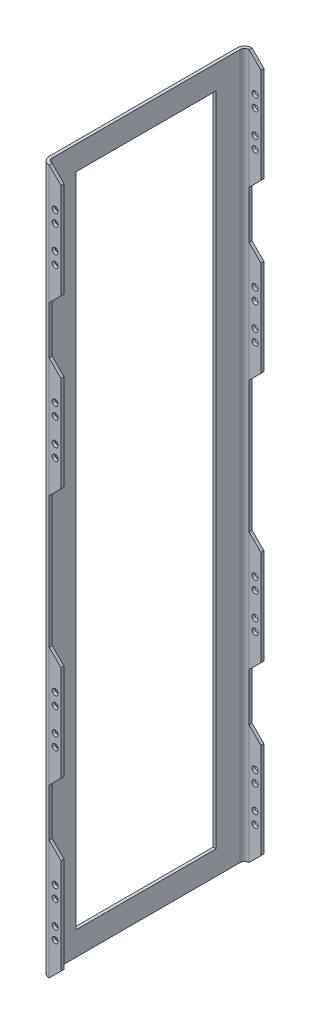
SolidWorks part; units mm, degrees
ref_plane "Front Plane" through (0, 0, 0) normal (0, 0, 1) x (1, 0, 0)
ref_plane "Top Plane" through (0, 0, 0) normal (0, 1, 0) x (1, 0, 0)
ref_plane "Right Plane" through (0, 0, 0) normal (1, 0, 0) x (0, 0, -1)
sketch "Sketch1" plane through (0, 0, 0) normal (0, 1, 0) x (1, 0, 0)
  line L0 (-51.5874, 0) -> (49.9999, 0) construction
  line L1 (-49.9999, -49.9999) -> (49.9999, -49.9999) construction
  line L2 (-49.9999, -49.9999) -> (-49.9999, 49.9999) construction
  line L3 (-49.9999, 49.9999) -> (49.9999, 49.9999) construction
  line L4 (49.9999, -49.9999) -> (49.9999, 49.9999) construction
  line L5 (-49.9999, -49.9999) -> (-51.5874, -49.9999) construction
  line L6 (-49.9999, 49.9999) -> (-49.9999, -49.9999)
  line L7 (-41.2686, -53.9686) -> (-41.2686, -52.3812)
  line L8 (-51.5874, 49.9999) -> (-51.5874, -49.9999)
  line L9 (-47.6186, -52.3811) -> (-41.2686, -52.3812)
  line L10 (-47.6186, -53.9686) -> (-41.2686, -53.9686)
  line L11 (-47.6186, 53.9686) -> (-41.2686, 53.9686)
  line L13 (-47.6186, 52.3811) -> (-41.2686, 52.3812)
  line L14 (-41.2686, 53.9686) -> (-41.2686, 52.3812)
  arc A0 (-47.6186, 52.3811) -> (-49.9999, 49.9999) centre (-47.6186, 49.9999) ccw
  arc A1 (-47.6186, 52.3811) -> (-49.9999, 49.9999) centre (-47.6186, 49.9999) ccw
  arc A2 (-47.6186, 53.9686) -> (-51.5874, 49.9999) centre (-47.6186, 49.9999) ccw
  arc A3 (-47.6186, -53.9686) -> (-51.5874, -49.9999) centre (-47.6186, -49.9999) cw
  arc A4 (-47.6186, -52.3811) -> (-49.9999, -49.9999) centre (-47.6186, -49.9999) cw
  arc A5 (-47.6186, -52.3811) -> (-49.9999, -49.9999) centre (-47.6186, -49.9999) cw
  circle A6 centre (0, 0) radius 76.2 construction
  dimension "D9" = 3.9688
  dimension "D7" = 152.4
  dimension "D1" = 49.9999
  dimension "D2" = 49.9999
  dimension "D3" = 6.35
  dimension "D4" = 49.9999
  dimension "D5" = 49.9999
  dimension "D6" = 1.5875
extrude "MainPlateExtrude" add sketch "Sketch1" along normal blind 374.65 contours L9 A4 L6 A0 L13 L14 L11 A2 L8 A3 L10 L7
sketch "Sketch2" plane through (0, 0, 53.9686) normal (0, 0, 1) x (1, 0, 0)
  line L0 (-47.6186, 374.65) -> (-41.2686, 368.3)
  line L1 (-41.2686, 374.65) -> (-41.2686, 0) construction
  line L2 (-47.6186, 285.75) -> (-41.2686, 279.4)
  line L3 (-47.6186, 374.65) -> (-47.6186, 0) construction
  line L4 (-41.2686, 317.5) -> (-47.6186, 311.15)
  line L5 (-47.6186, 374.65) -> (-41.2686, 374.65)
  line L6 (-41.2686, 374.65) -> (-41.2686, 368.3)
  line L7 (-41.2686, 317.5) -> (-41.2686, 0)
  line L8 (-41.2686, 0) -> (-47.6186, 0)
  line L9 (-47.6186, 0) -> (-41.2686, 6.35)
  line L10 (-47.6186, 63.5) -> (-41.2686, 57.15)
  line L11 (-47.6186, 88.9) -> (-41.2686, 95.25)
  line L12 (-47.6186, 152.4) -> (-41.2686, 146.05)
  line L13 (-47.6186, 222.25) -> (-41.2686, 228.6)
  line L14 (-47.6186, 311.15) -> (-47.6186, 285.75)
  line L15 (-47.6186, 222.25) -> (-47.6186, 152.4)
  line L16 (-47.6186, 88.9) -> (-47.6186, 63.5)
  dimension "D1" = 45
  dimension "D2" = 50.8
  dimension "D3" = 45
  dimension "D4" = 45
  dimension "D5" = 50.8
  dimension "D6" = 45
  dimension "D7" = 25.4
  dimension "D8" = 45
  dimension "D9" = 25.4
  dimension "D10" = 45
  dimension "D11" = 50.8
  dimension "D12" = 45
  dimension "D13" = 50.8
extrude "FlangeCut" cut sketch "Sketch2" against normal blind 107.95 contours L11 L10 M12 M10 | L9 M9 M10 | L13 L12 M12 M10 | L4 L2 M10 M12 | L0 M11 M10
sketch "Sketch3" plane through (-51.5874, 0, 0) normal (-1, 0, 0) x (0, 0, 1)
  line L0 (-37.2999, 361.95) -> (-37.2999, 12.7)
  line L1 (-49.9999, 374.65) -> (49.9999, 374.65) construction
  line L2 (-49.9999, 374.65) -> (-49.9999, 0) construction
  line L3 (-49.9999, 0) -> (49.9999, 0) construction
  line L4 (49.9999, 374.65) -> (49.9999, 0) construction
  line L5 (-37.2999, 12.7) -> (37.2999, 12.7)
  line L6 (37.2999, 361.95) -> (37.2999, 12.7)
  line L7 (-37.2999, 361.95) -> (37.2999, 361.95)
  dimension "D1" = 12.7
extrude "Cut-Extrude2" cut sketch "Sketch3" against normal blind 1.5875
sketch "Sketch4" plane through (0, 0, -53.9686) normal (0, 0, -1) x (-1, 0, 0)
  line L0 (41.2686, 342.9) -> (47.6186, 342.9) construction
  line L1 (41.2686, 368.3) -> (41.2686, 317.5) construction
  line L2 (47.6186, 374.65) -> (47.6187, 311.15) construction
  line L3 (41.2686, 254) -> (47.6186, 254) construction
  line L4 (41.2686, 279.4) -> (41.2686, 228.6) construction
  line L5 (47.6186, 285.75) -> (47.6186, 222.25) construction
  line L6 (41.2686, 120.65) -> (47.6186, 120.65) construction
  line L7 (41.2686, 146.05) -> (41.2686, 95.25) construction
  line L8 (47.6186, 152.4) -> (47.6187, 88.9) construction
  line L9 (41.2686, 31.75) -> (47.6186, 31.75) construction
  line L10 (41.2686, 57.15) -> (41.2686, 6.35) construction
  line L11 (47.6186, 63.5) -> (47.6186, 0) construction
  line L12 (44.4436, 31.75) -> (44.4436, 60.325) construction
  line L13 (41.2686, 57.15) -> (47.6186, 63.5) construction
  line L14 (44.4436, 31.75) -> (44.4436, 3.175) construction
  line L15 (41.2686, 6.35) -> (47.6186, 0) construction
  line L16 (44.4436, 120.65) -> (44.4436, 92.075) construction
  line L17 (44.4436, 120.65) -> (44.4436, 149.225) construction
  circle A0 centre (44.4436, 38.1) radius 1.5875
  circle A1 centre (44.4436, 25.4) radius 1.5875
  circle A2 centre (44.4436, 44.45) radius 1.5875
  circle A3 centre (44.4436, 19.05) radius 1.5875
  circle A4 centre (44.4436, 114.3) radius 1.5875
  circle A5 centre (44.4436, 127) radius 1.5875
  circle A6 centre (44.4436, 133.35) radius 1.5875
  circle A7 centre (44.4436, 107.95) radius 1.5875
  circle A8 centre (44.4436, 336.55) radius 1.5875
  circle A9 centre (44.4436, 260.35) radius 1.5875
  circle A10 centre (44.4436, 349.25) radius 1.5875
  circle A11 centre (44.4436, 241.3) radius 1.5875
  circle A12 centre (44.4436, 355.6) radius 1.5875
  circle A13 centre (44.4436, 266.7) radius 1.5875
  circle A14 centre (44.4436, 330.2) radius 1.5875
  circle A15 centre (44.4436, 247.65) radius 1.5875
  dimension "D1" = 3.175
  dimension "D2" = 3.175
  dimension "D5" = 3.175
  dimension "D6" = 3.175
  dimension "D8" = 6.35
  dimension "D9" = 3.175
  dimension "D3" = 6.35
  dimension "D4" = 6.35
  dimension "D7" = 6.35
extrude "Cut-Extrude3" cut sketch "Sketch4" against normal blind 127
